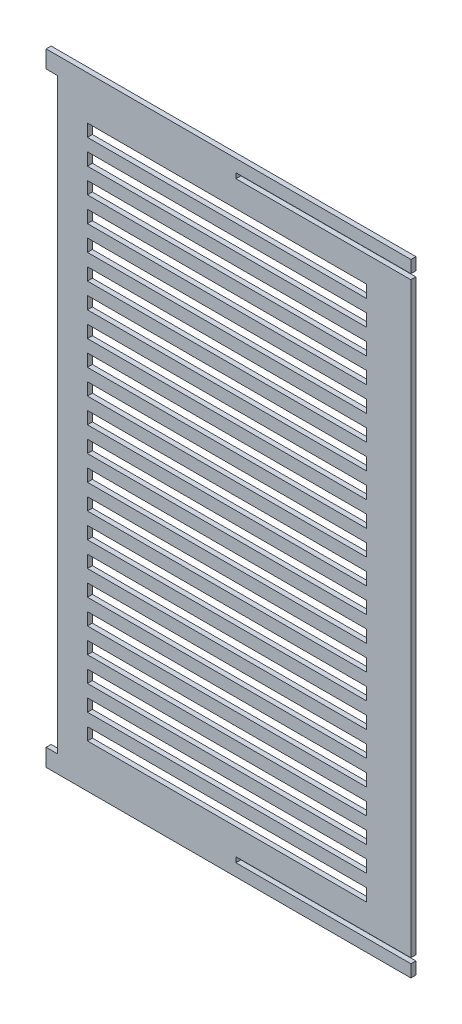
SolidWorks part; units mm, degrees
ref_plane "Спереди" through (0, 0, 0) normal (0, 0, 1) x (1, 0, 0)
ref_plane "Сверху" through (0, 0, 0) normal (0, 1, 0) x (1, 0, 0)
ref_plane "Справа" through (0, 0, 0) normal (1, 0, 0) x (0, 0, -1)
sketch "Model" plane through (0, 0, 0) normal (0, 0, 1) x (1, 0, 0)
  line L0 (-1702.5079, -905.5475) -> (-1926.881, -905.5475)
  line L1 (-1926.881, -905.5475) -> (-1926.881, -915.5475)
  line L2 (-1926.881, -915.5475) -> (-1702.5079, -915.5475)
  line L3 (-1702.5079, -915.5475) -> (-1702.5079, -905.5475)
  line L4 (-1702.5079, -885.5475) -> (-1926.881, -885.5475)
  line L5 (-1926.881, -885.5475) -> (-1926.881, -895.5475)
  line L6 (-1926.881, -895.5475) -> (-1702.5079, -895.5475)
  line L7 (-1702.5079, -895.5475) -> (-1702.5079, -885.5475)
  line L8 (-1702.5079, -865.5475) -> (-1926.881, -865.5475)
  line L9 (-1926.881, -865.5475) -> (-1926.881, -875.5475)
  line L10 (-1926.881, -875.5475) -> (-1702.5079, -875.5475)
  line L11 (-1702.5079, -875.5475) -> (-1702.5079, -865.5475)
  line L12 (-1702.5079, -845.5475) -> (-1926.881, -845.5475)
  line L13 (-1926.881, -845.5475) -> (-1926.881, -855.5475)
  line L14 (-1926.881, -855.5475) -> (-1702.5079, -855.5475)
  line L15 (-1702.5079, -855.5475) -> (-1702.5079, -845.5475)
  line L16 (-1702.5079, -825.5475) -> (-1926.881, -825.5475)
  line L17 (-1926.881, -825.5475) -> (-1926.881, -835.5475)
  line L18 (-1926.881, -835.5475) -> (-1702.5079, -835.5475)
  line L19 (-1702.5079, -835.5475) -> (-1702.5079, -825.5475)
  line L20 (-1702.5079, -805.5475) -> (-1926.881, -805.5475)
  line L21 (-1926.881, -805.5475) -> (-1926.881, -815.5475)
  line L22 (-1926.881, -815.5475) -> (-1702.5079, -815.5475)
  line L23 (-1702.5079, -815.5475) -> (-1702.5079, -805.5475)
  line L24 (-1702.5079, -785.5475) -> (-1926.881, -785.5475)
  line L25 (-1926.881, -785.5475) -> (-1926.881, -795.5475)
  line L26 (-1926.881, -795.5475) -> (-1702.5079, -795.5475)
  line L27 (-1702.5079, -795.5475) -> (-1702.5079, -785.5475)
  line L28 (-1702.5079, -765.5475) -> (-1926.881, -765.5475)
  line L29 (-1926.881, -765.5475) -> (-1926.881, -775.5475)
  line L30 (-1926.881, -775.5475) -> (-1702.5079, -775.5475)
  line L31 (-1702.5079, -775.5475) -> (-1702.5079, -765.5475)
  line L32 (-1702.5079, -745.5475) -> (-1926.881, -745.5475)
  line L33 (-1926.881, -745.5475) -> (-1926.881, -755.5475)
  line L34 (-1926.881, -755.5475) -> (-1702.5079, -755.5475)
  line L35 (-1702.5079, -755.5475) -> (-1702.5079, -745.5475)
  line L36 (-1702.5079, -725.5475) -> (-1926.881, -725.5475)
  line L37 (-1926.881, -725.5475) -> (-1926.881, -735.5475)
  line L38 (-1926.881, -735.5475) -> (-1702.5079, -735.5475)
  line L39 (-1702.5079, -735.5475) -> (-1702.5079, -725.5475)
  line L40 (-1702.5079, -705.5475) -> (-1926.881, -705.5475)
  line L41 (-1926.881, -705.5475) -> (-1926.881, -715.5475)
  line L42 (-1926.881, -715.5475) -> (-1702.5079, -715.5475)
  line L43 (-1702.5079, -715.5475) -> (-1702.5079, -705.5475)
  line L44 (-1702.5079, -685.5475) -> (-1926.881, -685.5475)
  line L45 (-1926.881, -685.5475) -> (-1926.881, -695.5475)
  line L46 (-1926.881, -695.5475) -> (-1702.5079, -695.5475)
  line L47 (-1702.5079, -695.5475) -> (-1702.5079, -685.5475)
  line L48 (-1702.5079, -665.5475) -> (-1926.881, -665.5475)
  line L49 (-1926.881, -665.5475) -> (-1926.881, -675.5475)
  line L50 (-1926.881, -675.5475) -> (-1702.5079, -675.5475)
  line L51 (-1702.5079, -675.5475) -> (-1702.5079, -665.5475)
  line L52 (-1702.5079, -645.5475) -> (-1926.881, -645.5475)
  line L53 (-1926.881, -645.5475) -> (-1926.881, -655.5475)
  line L54 (-1926.881, -655.5475) -> (-1702.5079, -655.5475)
  line L55 (-1702.5079, -655.5475) -> (-1702.5079, -645.5475)
  line L56 (-1702.5079, -625.5475) -> (-1926.881, -625.5475)
  line L57 (-1926.881, -625.5475) -> (-1926.881, -635.5475)
  line L58 (-1926.881, -635.5475) -> (-1702.5079, -635.5475)
  line L59 (-1702.5079, -635.5475) -> (-1702.5079, -625.5475)
  line L60 (-1702.5079, -605.5475) -> (-1926.881, -605.5475)
  line L61 (-1926.881, -605.5475) -> (-1926.881, -615.5475)
  line L62 (-1926.881, -615.5475) -> (-1702.5079, -615.5475)
  line L63 (-1702.5079, -615.5475) -> (-1702.5079, -605.5475)
  line L64 (-1702.5079, -585.5475) -> (-1926.881, -585.5475)
  line L65 (-1926.881, -585.5475) -> (-1926.881, -595.5475)
  line L66 (-1926.881, -595.5475) -> (-1702.5079, -595.5475)
  line L67 (-1702.5079, -595.5475) -> (-1702.5079, -585.5475)
  line L68 (-1702.5079, -565.5475) -> (-1926.881, -565.5475)
  line L69 (-1926.881, -565.5475) -> (-1926.881, -575.5475)
  line L70 (-1926.881, -575.5475) -> (-1702.5079, -575.5475)
  line L71 (-1702.5079, -575.5475) -> (-1702.5079, -565.5475)
  line L72 (-1702.5079, -545.5475) -> (-1926.881, -545.5475)
  line L73 (-1926.881, -545.5475) -> (-1926.881, -555.5475)
  line L74 (-1926.881, -555.5475) -> (-1702.5079, -555.5475)
  line L75 (-1702.5079, -555.5475) -> (-1702.5079, -545.5475)
  line L76 (-1702.5079, -525.5475) -> (-1926.881, -525.5475)
  line L77 (-1926.881, -525.5475) -> (-1926.881, -535.5475)
  line L78 (-1926.881, -535.5475) -> (-1702.5079, -535.5475)
  line L79 (-1702.5079, -535.5475) -> (-1702.5079, -525.5475)
  line L80 (-1702.5079, -505.5475) -> (-1926.881, -505.5475)
  line L81 (-1926.881, -505.5475) -> (-1926.881, -515.5475)
  line L82 (-1926.881, -515.5475) -> (-1702.5079, -515.5475)
  line L83 (-1702.5079, -515.5475) -> (-1702.5079, -505.5475)
  line L84 (-1702.5079, -485.5475) -> (-1926.881, -485.5475)
  line L85 (-1926.881, -485.5475) -> (-1926.881, -495.5475)
  line L86 (-1926.881, -495.5475) -> (-1702.5079, -495.5475)
  line L87 (-1702.5079, -495.5475) -> (-1702.5079, -485.5475)
  line L88 (-1807.5625, -460.5475) -> (-1807.5625, -464.5475)
  line L89 (-1807.5625, -464.5475) -> (-1807.5625, -464.6476)
  line L90 (-1807.5625, -464.6476) -> (-1666.9398, -464.6476)
  line L91 (-1666.9398, -464.6476) -> (-1666.9398, -936.4475)
  line L92 (-1666.9398, -936.4475) -> (-1807.5625, -936.4475)
  line L93 (-1807.5625, -936.4475) -> (-1807.5625, -936.5475)
  line L94 (-1807.5625, -936.5475) -> (-1807.5625, -940.5475)
  line L95 (-1807.5625, -940.5475) -> (-1807.5625, -940.6475)
  line L96 (-1807.5625, -940.6475) -> (-1666.9398, -940.6475)
  line L97 (-1666.9398, -940.6475) -> (-1666.9398, -950.5475)
  line L98 (-1666.9398, -950.5475) -> (-1960.0441, -950.5475)
  line L99 (-1960.0441, -950.5475) -> (-1960.0441, -936.5475)
  line L100 (-1960.0441, -936.5475) -> (-1950.9398, -936.5475)
  line L101 (-1950.9398, -936.5475) -> (-1950.9398, -464.5475)
  line L102 (-1950.9398, -464.5475) -> (-1960.0441, -464.5475)
  line L103 (-1960.0441, -464.5475) -> (-1960.0441, -450.5475)
  line L104 (-1960.0441, -450.5475) -> (-1666.9398, -450.5475)
  line L105 (-1666.9398, -450.5475) -> (-1666.9398, -460.4476)
  line L106 (-1666.9398, -460.4476) -> (-1807.5625, -460.4476)
  line L107 (-1807.5625, -460.4476) -> (-1807.5625, -460.5475)
extrude "Бобышка-Вытянуть1" add sketch "Model" along normal blind 4
